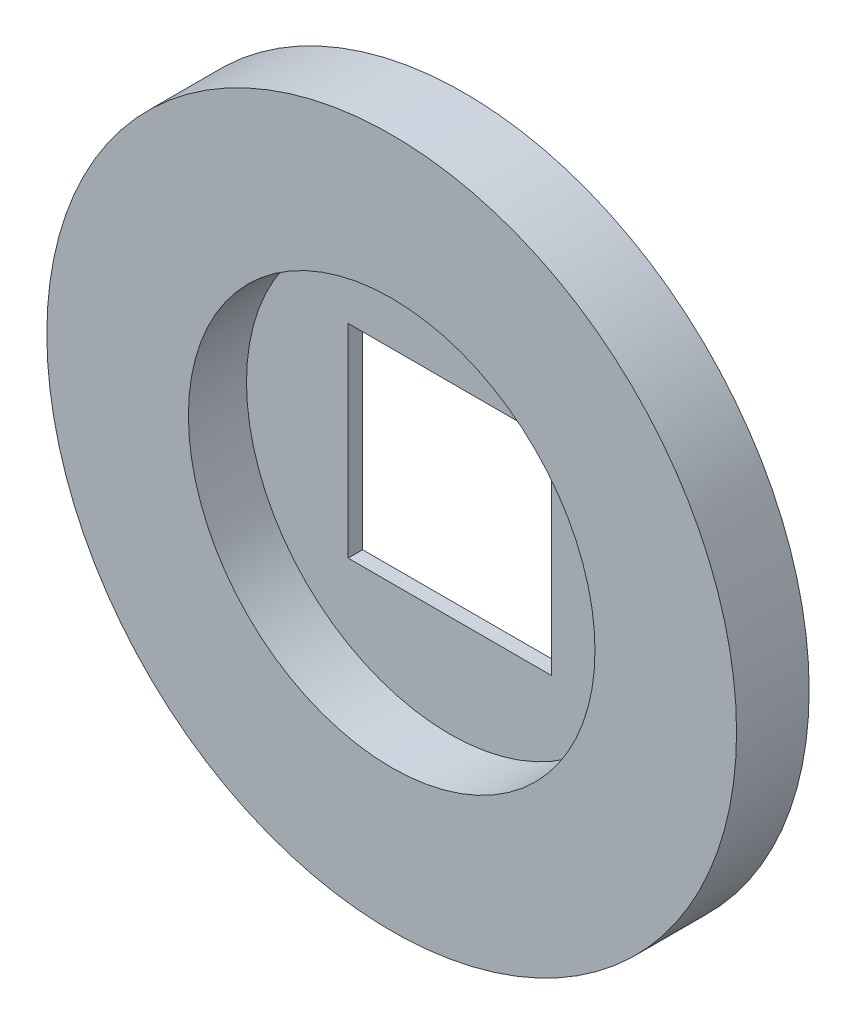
SolidWorks part; units mm, degrees
ref_plane "Face" through (0, 0, 0) normal (0, 0, 1) x (1, 0, 0)
ref_plane "Dessus" through (0, 0, 0) normal (0, 1, 0) x (1, 0, 0)
ref_plane "Droite" through (0, 0, 0) normal (1, 0, 0) x (0, 0, -1)
sketch "Esquisse1" plane through (0, 0, 0) normal (0, 0, 1) x (1, 0, 0)
  circle A0 centre (0, 0) radius 47.5
  dimension "D1" = 95
extrude "Base-Extrusion" add sketch "Esquisse1" along normal blind 10
sketch "Esquisse2" plane through (0, 0, 10) normal (0, 0, 1) x (1, 0, 0)
  circle A0 centre (0, 0) radius 28
  dimension "D1" = 56
extrude "Enlèv. mat.-Extru.1" cut sketch "Esquisse2" against normal blind 8
sketch "Esquisse3" plane through (0, 0, 2) normal (0, 0, 1) x (1, 0, 0)
  line L0 (14, 14) -> (-14, -14) construction
  line L1 (-14, 14) -> (14, 14)
  line L2 (-14, 14) -> (-14, -14)
  line L3 (-14, -14) -> (14, -14)
  line L4 (14, 14) -> (14, -14)
  dimension "D1" = 28
extrude "Enlèv. mat.-Extru.2" cut sketch "Esquisse3" against normal through all
